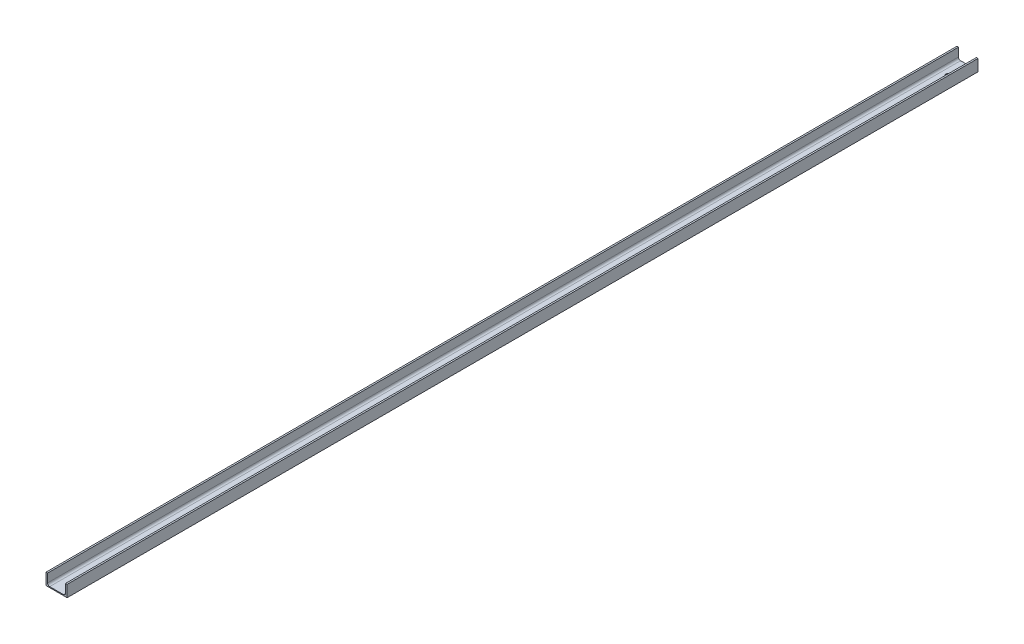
SolidWorks part; units mm, degrees
ref_plane "Plan de face" through (0, 0, 0) normal (0, 0, 1) x (1, 0, 0)
ref_plane "Plan de dessus" through (0, 0, 0) normal (0, 1, 0) x (1, 0, 0)
ref_plane "Plan de droite" through (0, 0, 0) normal (1, 0, 0) x (0, 0, -1)
sketch "Esquisse1" plane through (0, 0, 0) normal (0, 0, 1) x (1, 0, 0)
  line L0 (0, 0) -> (100, 0)
  line L1 (100, 0) -> (100, 55)
  line L2 (100, 55) -> (92.5, 55)
  line L3 (92.5, 55) -> (92.5, 14.5)
  line L4 (82.5, 4.5) -> (17.5, 4.5)
  line L5 (7.5, 14.5) -> (7.5, 55)
  line L6 (0, 0) -> (0, 55)
  line L7 (0, 55) -> (7.5, 55)
  arc A0 (17.5, 4.5) -> (7.5, 14.5) centre (17.5, 14.5) cw
  arc A1 (92.5, 14.5) -> (82.5, 4.5) centre (82.5, 14.5) cw
  dimension "D7" = 10
  dimension "D1" = 100
  dimension "D2" = 55
  dimension "D3" = 7.5
  dimension "D4" = 7.5
  dimension "D5" = 4.5
  dimension "D6" = 55
extrude "Extrusion1" add sketch "Esquisse1" along normal blind 4317 contours L1 L2 L3 A1 L4 A0 L5 L7 L6 L0
sketch "Esquisse2" plane through (0, 4.5, 0) normal (0, 1, 0) x (-1, 0, 0)
  line L2 (0, 4317) -> (0, 0) construction
  line L3 (-100, 4317) -> (-100, 0) construction
  line L4 (-82.5, 0) -> (-17.5, 0) construction
  circle A0 centre (-50, 185) radius 7.5
  circle A1 centre (-50, 494) radius 7.5
  circle A2 centre (-50, 803) radius 7.5
  circle A3 centre (-50, 1112) radius 7.5
  circle A4 centre (-50, 1421) radius 7.5
  circle A5 centre (-50, 1730) radius 7.5
  circle A6 centre (-50, 2039) radius 7.5
  circle A7 centre (-50, 2348) radius 7.5
  circle A8 centre (-50, 2657) radius 7.5
  circle A9 centre (-50, 2966) radius 7.5
  circle A10 centre (-50, 3275) radius 7.5
  circle A11 centre (-50, 3584) radius 7.5
  circle A12 centre (-50, 3893) radius 7.5
  circle A13 centre (-50, 4202) radius 7.5
  circle A14 centre (-50, 90) radius 12.5
  dimension "D1" = 15
  dimension "D2" = 90
  dimension "D3" = 50
  dimension "D4" = 25
  dimension "D5" = 50
  dimension "D6" = 95
extrude "Enlèv. mat.-Extru.1" cut sketch "Esquisse2" against normal through all
